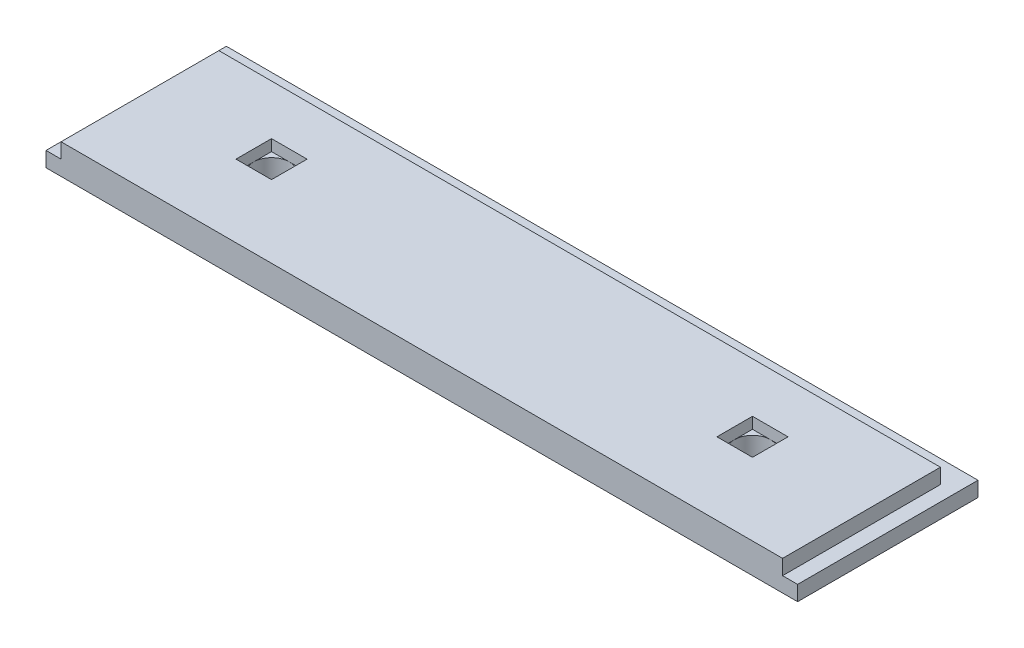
SolidWorks part; units mm, degrees
ref_plane "Front Plane" through (0, 0, 0) normal (0, 0, 1) x (1, 0, 0)
ref_plane "Top Plane" through (0, 0, 0) normal (0, 1, 0) x (1, 0, 0)
ref_plane "Right Plane" through (0, 0, 0) normal (1, 0, 0) x (0, 0, -1)
sketch "Sketch1" plane through (0, 0, 0) normal (0, 0, 1) x (1, 0, 0)
  line L0 (0, 0) -> (2540, 0)
  line L1 (2540, 0) -> (2540, 50.8)
  line L2 (2540, 50.8) -> (2489.2, 50.8)
  line L3 (2489.2, 50.8) -> (2489.2, 101.6)
  line L4 (2489.2, 101.6) -> (50.8, 101.6)
  line L5 (50.8, 101.6) -> (50.8, 50.8)
  line L6 (50.8, 50.8) -> (0, 50.8)
  line L7 (0, 50.8) -> (0, 0)
  dimension "D1" = 2540
  dimension "D2" = 2438.4
  dimension "D3" = 50.8
  dimension "D4" = 50.8
  dimension "D5" = 101.6
extrude "Boss-Extrude1" add sketch "Sketch1" along normal blind 609.6
sketch "Sketch2" plane through (0, 101.6, 0) normal (0, 1, 0) x (1, 0, 0)
  line L0 (397.256, -304.8) -> (0, -304.8) construction
  line L1 (397.256, -244.729) -> (517.398, -244.729)
  line L2 (397.256, -244.729) -> (397.256, -364.871)
  line L3 (397.256, -364.871) -> (517.398, -364.871)
  line L4 (517.398, -244.729) -> (517.398, -364.871)
  line L5 (2022.602, -244.729) -> (2142.744, -244.729)
  line L6 (2022.602, -244.729) -> (2022.602, -364.871)
  line L7 (2022.602, -364.871) -> (2142.744, -364.871)
  line L8 (2142.744, -244.729) -> (2142.744, -364.871)
  line L9 (0, -609.6) -> (0, 0) construction
  line L10 (517.398, -304.8) -> (2022.602, -304.8) construction
  line L12 (2142.744, -304.8) -> (2540, -304.8) construction
  line L13 (2540, -609.6) -> (2540, 0) construction
  dimension "D1" = 120.142
  dimension "D2" = 120.142
  dimension "D3" = 120.142
  dimension "D4" = 120.142
  dimension "D5" = 397.256
  dimension "D6" = 397.256
extrude "Cut-Extrude1" cut sketch "Sketch2" against normal blind 38.1
sketch "Sketch4" plane through (0, 0, 0) normal (0, -1, 0) x (1, 0, 0)
  line L0 (0, 304.8) -> (457.2, 304.8) construction
  line L1 (0, 609.6) -> (0, 0) construction
  line L2 (457.2, 304.8) -> (2082.8, 304.8) construction
  line L3 (0, 0) -> (2540, 0) construction
  circle A0 centre (457.2, 304.8) radius 76.2
  circle A1 centre (2082.8, 304.8) radius 76.2
  dimension "D1" = 152.4
  dimension "D2" = 457.2
  dimension "D3" = 1625.6
  dimension "D4" = 304.8
extrude "Boss-Extrude2" add sketch "Sketch4" along normal blind 177.8
sketch "Sketch5" plane through (0, 101.6, 0) normal (0, 1, 0) x (1, 0, 0)
  line L0 (0, -609.6) -> (0, 0) construction
  line L1 (2489.2, -609.6) -> (50.8, -609.6) construction
  line L2 (457.327, -304.8) -> (2082.673, -304.8) construction
  circle A0 centre (457.327, -304.8) radius 60.071
  circle A1 centre (2082.673, -304.8) radius 60.071
  dimension "D1" = 120.142
  dimension "D2" = 457.327
  dimension "D3" = 304.8
  dimension "D4" = 1625.346
extrude "Cut-Extrude2" cut sketch "Sketch5" against normal up to next
sketch "Sketch6" plane through (50.8, 0, 0) normal (-1, 0, 0) x (0, 0, 1)
  line L0 (609.6, 50.8) -> (0, 50.8) construction
  line L1 (0, 101.6) -> (76.2, 101.6)
  line L2 (0, 101.6) -> (0, 50.8)
  line L3 (0, 50.8) -> (76.2, 50.8)
  line L4 (76.2, 101.6) -> (76.2, 50.8)
  dimension "D1" = 76.2
extrude "Cut-Extrude3" cut sketch "Sketch6" against normal up to next and the other way through all
